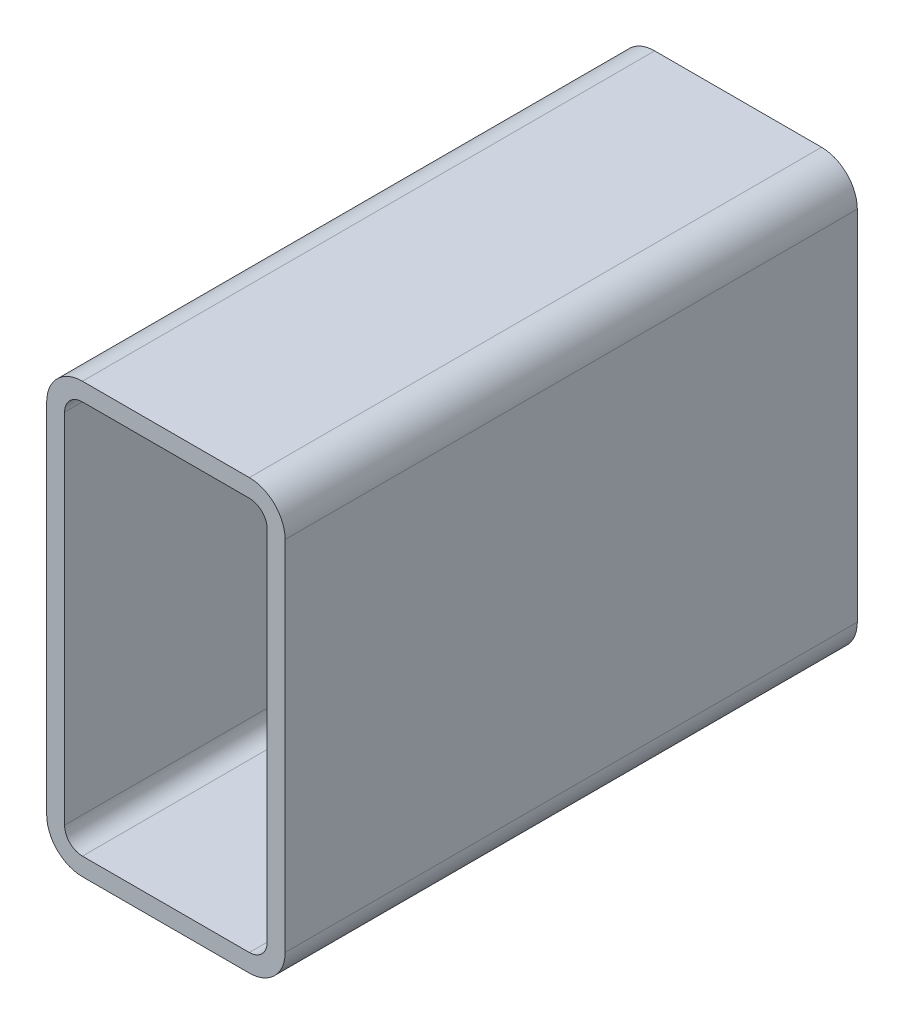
SolidWorks part; units mm, degrees
ref_plane "Front Plane" through (0, 0, 0) normal (0, 0, 1) x (1, 0, 0)
ref_plane "Top Plane" through (0, 0, 0) normal (0, 1, 0) x (1, 0, 0)
ref_plane "Right Plane" through (0, 0, 0) normal (1, 0, 0) x (0, 0, -1)
sketch "Sketch1" plane through (0, 0, 0) normal (0, 0, 1) x (1, 0, 0)
sketch_block_instance "HSS9x5x0.375-1"
sketch_block "HSS9x5x0.375"
extrude "Boss-Extrude1" add sketch "Sketch1" along normal blind 304.8
